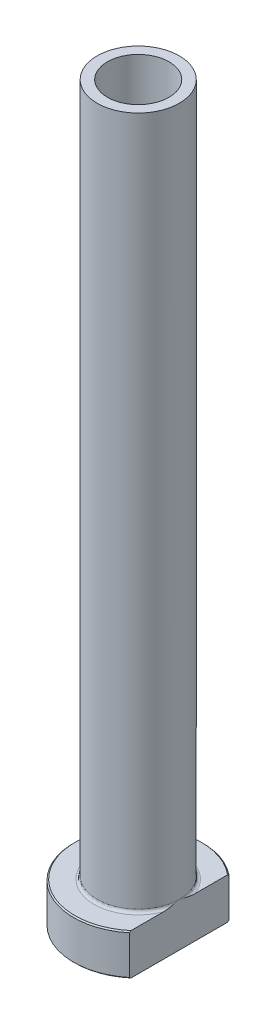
SolidWorks part; units mm, degrees
ref_plane "Front Plane" through (0, 0, 0) normal (0, 0, 1) x (1, 0, 0)
ref_plane "Top Plane" through (0, 0, 0) normal (0, 1, 0) x (1, 0, 0)
ref_plane "Right Plane" through (0, 0, 0) normal (1, 0, 0) x (0, 0, -1)
sketch "Sketch1" plane through (0, 0, 0) normal (0, 0, 1) x (1, 0, 0)
  line L0 (-5.25, 125) -> (-7, 125)
  line L1 (-7, 125) -> (-7, 7)
  line L2 (-7, 7) -> (-11, 7)
  line L3 (-11, 7) -> (-11, 0)
  line L4 (9.9, 0) -> (-9.9, 0) construction
  line L5 (-11, 0) -> (-5.5, 0)
  line L6 (-5.25, 70) -> (-5.25, 125)
  line L7 (0, 92.1877) -> (0, -15.5353) construction
  line L8 (0, -12.1) -> (0, 12.1) construction
  line L9 (-5.25, 70) -> (-5.5, 58)
  line L10 (-5.5, 58) -> (-5.5, 0)
  dimension "D1" = 0.25
  dimension "ID" = 10.5
  dimension "OD" = 14
  dimension "L" = 125
  dimension "H" = 22
  dimension "T" = 7
  dimension "N" = 55
  dimension "D2" = 12
  dimension "L-N" = 70
revolve "Revolve1" add sketch "Sketch1" angle 360 about L7
fillet "Fillet1" radius 0.5 1 edges at (0, 7, 7)
chamfer "Chamfer1" distance 0.2 angle 45 2 edges at (0, 7, 11) (0, 0, 11)
sketch "Sketch2" plane through (0, 0, 0) normal (0, -1, 0) x (1, 0, 0)
  line L0 (7, 8.4853) -> (7, -8.4853)
  circle A0 centre (0, 0) radius 11 construction
  arc A1 (7, 8.4853) -> (7, -8.4853) centre (0, 0) cw
  circle A2 centre (0, 0) radius 7 construction
extrude "Cut-Extrude1" cut sketch "Sketch2" against normal through all
chamfer "Chamfer2" distance 0.5 angle 45 1 edges at (0, 0, 5.5)
